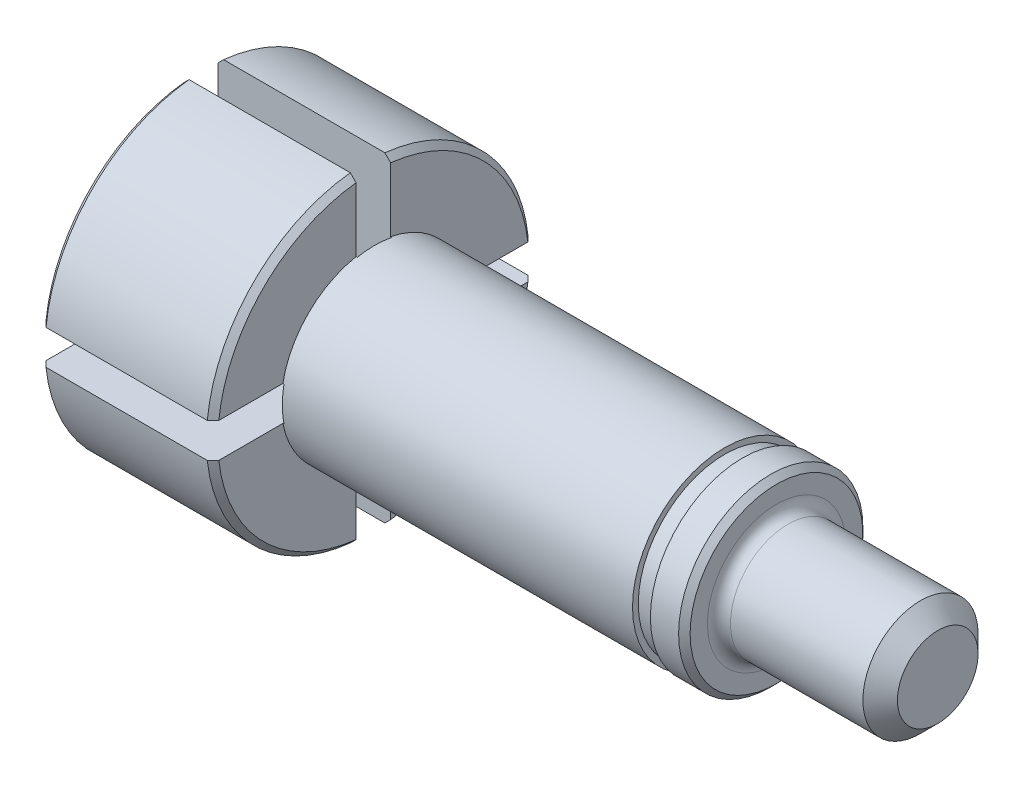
SolidWorks part; units mm, degrees
ref_plane "Face" through (0, 0, 0) normal (0, 0, 1) x (1, 0, 0)
ref_plane "Dessus" through (0, 0, 0) normal (0, 1, 0) x (1, 0, 0)
ref_plane "Droite" through (0, 0, 0) normal (1, 0, 0) x (0, 0, -1)
sketch "Esquisse1" plane through (0, 0, 0) normal (0, 0, 1) x (1, 0, 0)
  line L0 (-14.9538, 0) -> (117.6628, 0) construction
  line L1 (0, 0) -> (0, 15)
  line L2 (0, 15) -> (68, 15)
  line L3 (68, 15) -> (68, 0)
  line L4 (0, 0) -> (68, 0)
  dimension "D1" = 30
  dimension "D2" = 68
revolve "Brut Ø30 x 50" add sketch "Esquisse1" angle 360 about L0
sketch "Esquisse2" plane through (0, 0, 0) normal (0, 0, 1) x (1, 0, 0)
  line L0 (-1.6041, 0) -> (52.6213, 0) construction
  line L1 (-14.9538, 0) -> (117.6628, 0) construction
  line L2 (0, 15) -> (0, -15) construction
  line L3 (68, 15) -> (0, 15) construction
  line L4 (0, 15) -> (0, 0)
  line L5 (24, 15) -> (0, 15)
  line L6 (2, 0) -> (2, 13.5)
  line L7 (2, 13.5) -> (2.5, 14)
  line L8 (24, 14) -> (24, 15)
  line L9 (2, 0) -> (0, 0)
  line L10 (68, -15) -> (68, 15) construction
  line L11 (2.5, 14) -> (24, 14)
  point P16 (2, 14)
  dimension "D1" = 22
  dimension "D2" = 66
  dimension "D3" = 28
  dimension "D7" = 0.5
revolve "Phase 10" cut sketch "Esquisse2" angle 360 about L0
sketch "Esquisse3" plane through (0, 0, 0) normal (0, 0, 1) x (1, 0, 0)
  line L0 (-5.5108, 0) -> (65.8821, 0) construction
  line L1 (51.5, 8) -> (52, 7.5)
  line L2 (17, 13.5) -> (17, 8)
  line L3 (17, 8) -> (47.5, 8)
  line L4 (52, 7.5) -> (52, 6)
  line L5 (53, 5) -> (64.5, 5)
  line L6 (66, 3.5) -> (66, 0)
  line L11 (2, 13.5) -> (2, -13.5) construction
  line L12 (68, -15) -> (68, 15) construction
  line L13 (24, 14) -> (2.5, 14) construction
  line L14 (68, 0) -> (68, 15)
  line L15 (66, 0) -> (68, 0)
  line L18 (64.5, 5) -> (66, 3.5)
  line L19 (47.5, 8) -> (47.5, 7.5)
  line L20 (47.5, 7.5) -> (49.05, 7.5)
  line L21 (49.05, 7.5) -> (49.05, 8)
  line L22 (49.05, 8) -> (51.5, 8)
  line L24 (17, 13.5) -> (15.5, 15)
  line L25 (68, 15) -> (24, 15) construction
  line L26 (68, 15) -> (15.5, 15)
  arc A0 (52, 6) -> (53, 5) centre (53, 6) ccw
  point P7 (52, 8)
  point P8 (66, 5)
  dimension "D6" = 35
  dimension "D16" = 0.5
  dimension "D7" = 1
  dimension "D1" = 15
  dimension "D2" = 0.5
  dimension "D3" = 135
  dimension "D4" = 16
  dimension "D5" = 30.5
  dimension "D11" = 1.5
  dimension "D12" = 1.5
  dimension "D8" = 0.5
  dimension "D9" = 10
  dimension "D10" = 14
  dimension "D14" = 1.55
revolve "Phase 20" cut sketch "Esquisse3" angle 360 about L0
sketch "Esquisse4" plane through (2, 0, 0) normal (-1, 0, 0) x (0, 0, 1)
  line L0 (1.5, -1.5) -> (1.5, -15.9295)
  line L1 (-15.9295, 1.5) -> (-1.5, 1.5)
  line L3 (-15.9295, -1.5) -> (-1.5, -1.5)
  line L4 (-1.5, -1.5) -> (-1.5, -15.9295)
  line L6 (-1.5, 15.9295) -> (-1.5, 1.5)
  line L7 (1.5, 1.5) -> (15.9295, 1.5)
  line L8 (1.5, 15.9295) -> (1.5, 1.5)
  line L9 (1.5, -1.5) -> (15.9295, -1.5)
  arc A1 (15.9295, -1.5) -> (15.9295, 1.5) centre (0, 0) ccw
  arc A2 (1.5, 15.9295) -> (-1.5, 15.9295) centre (0, 0) ccw
  arc A3 (-15.9295, 1.5) -> (-15.9295, -1.5) centre (0, 0) ccw
  arc A4 (-1.5, -15.9295) -> (1.5, -15.9295) centre (0, 0) ccw
  dimension "D5" = 32
  dimension "D1" = 1.5
  dimension "D2" = 3
  dimension "D3" = 3
  dimension "D4" = 1.5
extrude "Phase 30" cut sketch "Esquisse4" against normal blind 15.1
